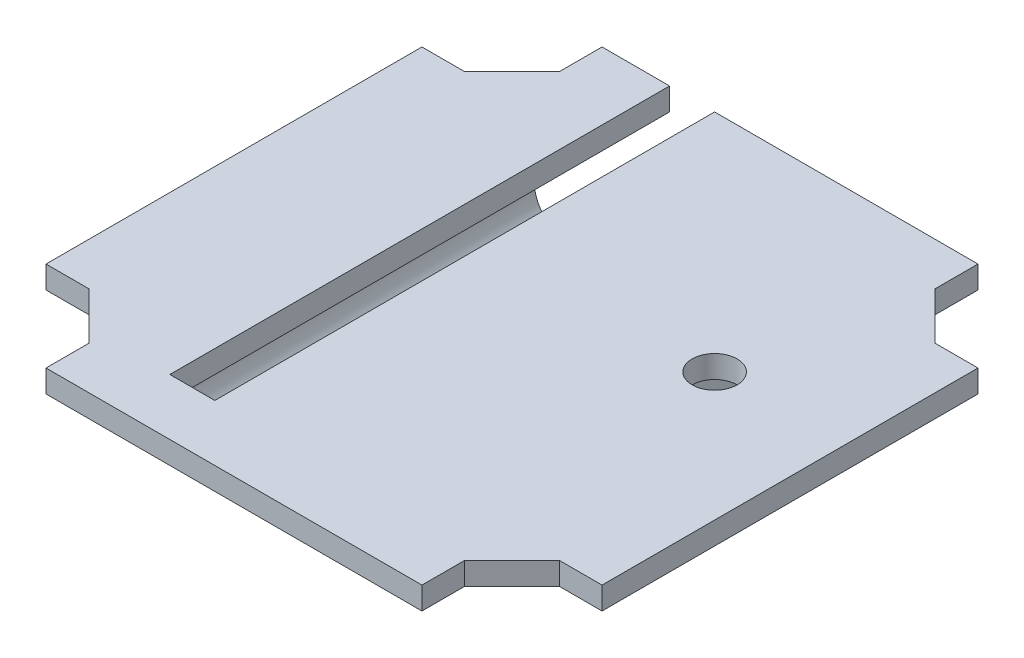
SolidWorks part; units mm, degrees
ref_plane "Ebene vorne" through (0, 0, 0) normal (0, 0, 1) x (1, 0, 0)
ref_plane "Ebene oben" through (0, 0, 0) normal (0, 1, 0) x (1, 0, 0)
ref_plane "Ebene rechts" through (0, 0, 0) normal (1, 0, 0) x (0, 0, -1)
sketch "Skizze1" plane through (0, 0, 0) normal (0, 1, 0) x (1, 0, 0)
  line L0 (-24.7, -16.7) -> (-20.9, -16.7)
  line L1 (-24.7, -24.7) -> (24.7, -24.7)
  line L2 (-24.7, -24.7) -> (-24.7, 24.7)
  line L3 (-24.7, 24.7) -> (24.7, 24.7)
  line L4 (24.7, -24.7) -> (24.7, 24.7)
  line L5 (-24.7, -24.7) -> (24.7, 24.7) construction
  line L6 (-24.7, 24.7) -> (24.7, -24.7) construction
  line L7 (-20.9, -16.7) -> (-16.7, -20.9)
  line L8 (-16.7, -20.9) -> (-16.7, -24.7)
  line L9 (-16.7, 20.9) -> (-20.9, 16.7)
  line L10 (-16.7, 24.7) -> (-16.7, 20.9)
  line L11 (-20.9, 16.7) -> (-24.7, 16.7)
  line L12 (20.9, 16.7) -> (16.7, 20.9)
  line L13 (24.7, 16.7) -> (20.9, 16.7)
  line L14 (16.7, 20.9) -> (16.7, 24.7)
  line L15 (16.7, -20.9) -> (20.9, -16.7)
  line L16 (16.7, -24.7) -> (16.7, -20.9)
  line L17 (20.9, -16.7) -> (24.7, -16.7)
  point P0 (0, 0)
  point P25 (0, 0)
  dimension "D1" = 49.4
  dimension "D2" = 3.8
  dimension "D3" = 8
  dimension "D4" = 4
extrude "Aufsatz-Linear austragen1" add sketch "Skizze1" along normal blind 2 contours L15 L17 L4 L13 L12 L14 L3 L10 L9 L11 L2 L0 L7 L8 L1 L16
sketch "Skizze2" plane through (0, 0, 0) normal (0, 0, 1) x (1, 0, 0)
  line L0 (-16.7, 0) -> (16.7, 0) construction
  line L1 (-25, 42) -> (25, 42)
  line L2 (-25, 42) -> (-25, -8)
  line L3 (-25, -8) -> (25, -8)
  line L4 (25, 42) -> (25, -8)
  line L5 (-25, 42) -> (25, -8) construction
  line L6 (-25, -8) -> (25, 42) construction
  line L7 (0, -27.17) -> (0, 27.17) construction
  point P0 (0, 17)
  dimension "D1" = 50
  dimension "D2" = 8
sketch "Skizze3" plane through (0, 0, 0) normal (1, 0, 0) x (0, 0, -1)
  line L1 (-25, -8) -> (25, -8)
  line L2 (-25, -8) -> (-25, 42)
  line L3 (-25, 42) -> (25, 42)
  line L4 (25, -8) -> (25, 42)
  line L5 (-25, -8) -> (25, 42) construction
  line L6 (-25, 42) -> (25, -8) construction
  point P0 (0, 17)
  dimension "D1" = 50
sketch "Skizze4" plane through (0, 0, 24.7) normal (0, 0, 1) x (1, 0, 0)
  line L0 (-16.7, 0) -> (16.7, 0) construction
  line L1 (9.3, 0) -> (-15.7, 0)
  line L2 (9.3, 0) -> (9.3, -6)
  line L3 (9.3, -6) -> (-15.7, -6)
  line L4 (-15.7, 0) -> (-15.7, -6)
  line L6 (-3.2, 0) -> (-3.2, -6) construction
  line L7 (-16.7, 2) -> (-16.7, 0) construction
  line L8 (-11.2, -3) -> (4.8, -3) construction
  line L9 (-11.2, 0) -> (4.8, 0)
  line L10 (-11.2, -6) -> (4.8, -6)
  arc A0 (-11.2, 0) -> (-11.2, -6) centre (-11.2, -3) ccw
  arc A1 (4.8, -6) -> (4.8, 0) centre (4.8, -3) ccw
  point P12 (-3.2, -3)
  dimension "D1" = 6
  dimension "D2" = 1
  dimension "D3" = 16
  dimension "D4" = 4.5
extrude "Aufsatz-Linear austragen2" add sketch "Skizze4" against normal offset from surface (32.4 mm away) 8.5 from offset 8.5 contours A0 L4 L3 M3 | A1 L3 L2 M3
fillet "Verrundung1" radius 0.2 2 edges at (4.8, -6, 0) (-11.2, -6, 0)
fillet "Verrundung2" radius 1 2 edges at (9.3, 0, 0) (-15.7, 0, 0)
sketch "Skizze5" plane through (0, 2, 0) normal (0, 1, 0) x (1, 0, 0)
  line L1 (-10.7, 24.7) -> (-6.7, 24.7)
  line L2 (-10.7, 24.7) -> (-10.7, -19.7)
  line L3 (-10.7, -19.7) -> (-6.7, -19.7)
  line L4 (-6.7, 24.7) -> (-6.7, -19.7)
  line L6 (-16.7, 24.7) -> (-16.7, 20.9) construction
  line L7 (-16.7, 24.7) -> (16.7, 24.7) construction
  line L8 (-16.7, -24.7) -> (16.7, -24.7) construction
  dimension "D1" = 6
  dimension "D2" = 4
  dimension "D3" = 5
extrude "Schnitt-Linear austragen1" cut sketch "Skizze5" against normal through all both and the other way through all
sketch "Skizze6" plane through (0, 2, 0) normal (0, 1, 0) x (1, 0, 0)
  line L0 (-6.7, 24.7) -> (16.7, 24.7) construction
  line L2 (-8.7, -19.7) -> (-8.7, 24.7026) construction
  line L3 (-10.7, -19.7) -> (-6.7, -19.7) construction
  circle A0 centre (13.3, 4.7) radius 2
  dimension "D3" = 4
  dimension "D1" = 20
  dimension "D2" = 22
extrude "Schnitt-Linear austragen2" cut sketch "Skizze6" against normal through all both and the other way through all
